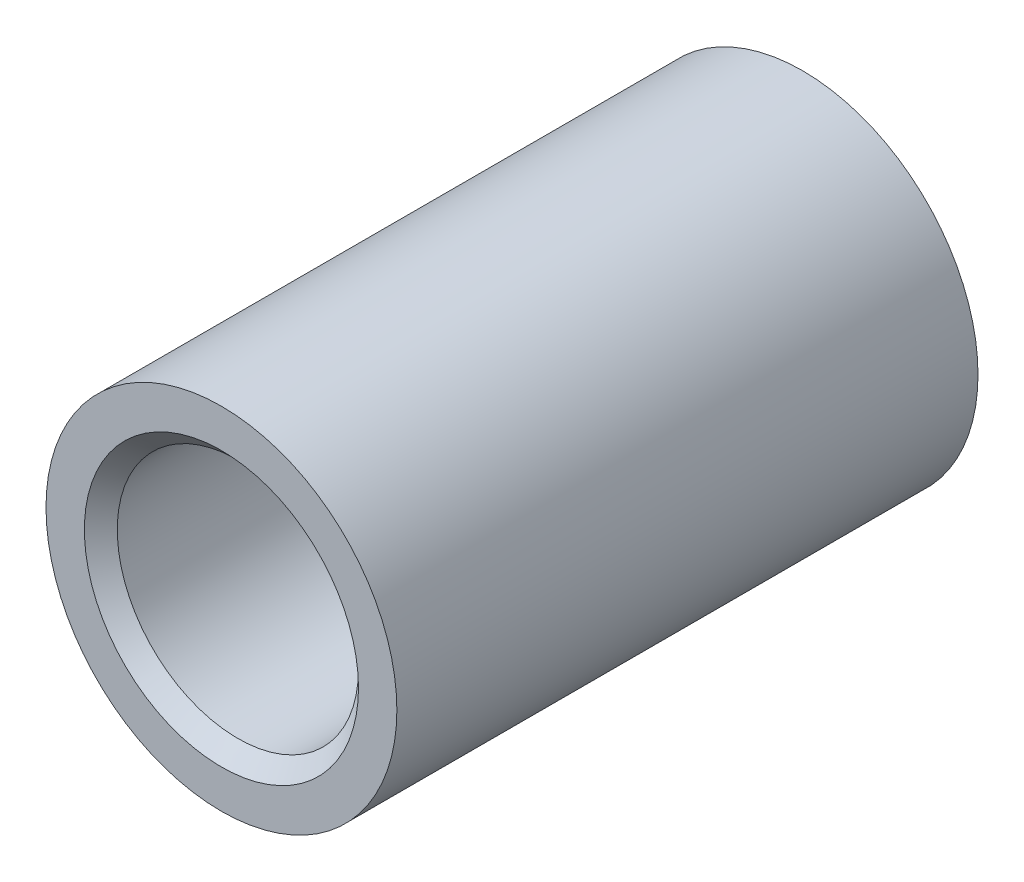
SolidWorks part; units mm, degrees
ref_plane "Ön Düzlem" through (0, 0, 0) normal (0, 0, 1) x (1, 0, 0)
ref_plane "Üst Düzlem" through (0, 0, 0) normal (0, 1, 0) x (1, 0, 0)
ref_plane "Sağ Düzlem" through (0, 0, 0) normal (1, 0, 0) x (0, 0, -1)
sketch "Çizim2" plane through (0, 0, 0) normal (0, 0, 1) x (1, 0, 0)
  circle A0 centre (0, 0) radius 11
  circle A1 centre (0, 0) radius 16
  dimension "D1" = 32
  dimension "D2" = 22
extrude "Yükseklik-Ekstrüzyon1" add sketch "Çizim2" along normal blind 53
chamfer "Pah2" distance 1.5 angle 45 2 edges at (11, 0, 0) (11, 0, 53)
